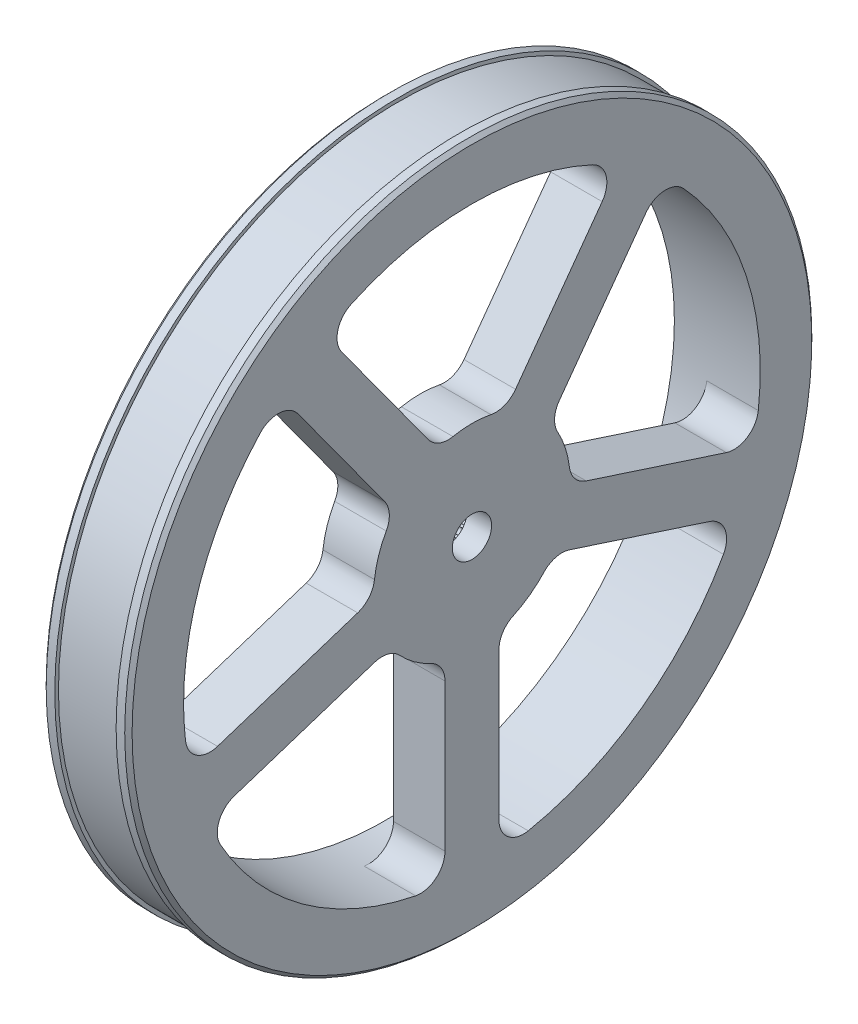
SolidWorks part; units mm, degrees
ref_plane "Plan de face" through (0, 0, 0) normal (0, 0, 1) x (1, 0, 0)
ref_plane "Plan de dessus" through (0, 0, 0) normal (0, 1, 0) x (1, 0, 0)
ref_plane "Plan de droite" through (0, 0, 0) normal (1, 0, 0) x (0, 0, -1)
sketch "Esquisse1" plane through (0, 0, 0) normal (0, 0, 1) x (1, 0, 0)
  line L0 (-5.3258, 2.3) -> (-3.1258, 2.3)
  line L1 (-3.1258, 2.3) -> (-3.1258, 1.6)
  line L2 (-3.1258, 1.6) -> (-1.1258, 1.6)
  line L3 (-1.1258, 1.6) -> (-1.1258, 27.7)
  line L4 (-1.4258, 28) -> (-2.1258, 28)
  line L5 (-8.1258, 27.7) -> (-8.1258, 23.5)
  line L7 (-5.3258, 23.5) -> (-5.3258, 2.3)
  line L8 (0, 0) -> (16.3254, 0) construction
  line L10 (-5.3258, 23.5) -> (-8.1258, 23.5)
  line L11 (-7.8258, 28) -> (-8.1258, 27.7)
  line L12 (-1.1258, 27.7) -> (-1.4258, 28)
  line L13 (-7.1258, 28) -> (-7.8258, 28)
  line L15 (-7.1258, 28) -> (-7.1258, 27.7)
  line L16 (-7.1258, 27.7) -> (-2.1258, 27.7)
  line L17 (-2.1258, 28) -> (-2.1258, 27.7)
  point P11 (-8.1258, 28)
  point P14 (-1.1258, 28)
  dimension "D8" = 5
  dimension "D9" = 0.3
  dimension "D6" = 4.5
  dimension "D1" = 28
  dimension "D2" = 2.2
  dimension "D3" = 2
  dimension "D4" = 2.3
  dimension "D5" = 1.6
  dimension "D12" = 1
  dimension "D7" = 7
revolve "Révolution1" add sketch "Esquisse1" angle 360 about L8
sketch "Esquisse2" plane through (-5.3258, 0, 0) normal (-1, 0, 0) x (0, 0, 1)
  line L2 (-5.0423, -3.1973) -> (18.803, 29.623) construction
  line L5 (6.668, -5.4348) -> (-21.6614, 33.5573) construction
  line L6 (0, 0) -> (0, -24) construction
  line L7 (3.5545, 8.6352) -> (10.6141, 18.3519)
  line L8 (-10.6141, 18.3519) -> (-3.5545, 8.6352)
  arc A2 (1.5491, 7.8486) -> (-1.5491, 7.8486) centre (0, 0) ccw
  arc A5 (9.8329, 21.344) -> (-9.8329, 21.344) centre (0, 0) ccw
  arc A6 (-3.5545, 8.6352) -> (-1.5491, 7.8486) centre (-1.9364, 9.8107) ccw
  arc A7 (3.5545, 8.6352) -> (1.5491, 7.8486) centre (1.9364, 9.8107) cw
  arc A8 (-9.8329, 21.344) -> (-10.6141, 18.3519) centre (-8.996, 19.5275) ccw
  arc A9 (10.6141, 18.3519) -> (9.8329, 21.344) centre (8.996, 19.5275) ccw
  point P7 (-2.7411, 7.5157)
  point P21 (2.7411, 7.5157)
  point P24 (-12.2729, 20.635)
  point P27 (12.2164, 20.5572)
  dimension "D3" = 2.2
  dimension "D7" = 16
  dimension "D8" = 2
  dimension "D9" = 2
  dimension "D10" = 2
  dimension "D11" = 2
  dimension "D2" = 23.5
  dimension "D4" = 144
  dimension "D5" = 2.2
  dimension "D6" = 144
extrude "Enlèv. mat.-Extru.1" cut sketch "Esquisse2" against normal blind 10
pattern_circular "Répétition circulaire2" count 5 over 360 about axis through (0, 0, 0) along (1, 0, 0) of "Enlèv. mat.-Extru.1"
sketch "Esquisse4" plane through (-5.3258, 0, 0) normal (-1, 0, 0) x (0, 0, 1)
  circle A0 centre (0, 2.3) radius 0.25
  circle A1 centre (0, 0) radius 2.3 construction
  circle A2 centre (0, 0) radius 2.3 construction
  dimension "D1" = 0.5
extrude "Enlèv. mat.-Extru.3" cut sketch "Esquisse4" against normal blind 2.2
pattern_circular "Répétition circulaire4" count 21 over 360 about axis through (0, 0, 0) along (1, 0, 0) of "Enlèv. mat.-Extru.3"
